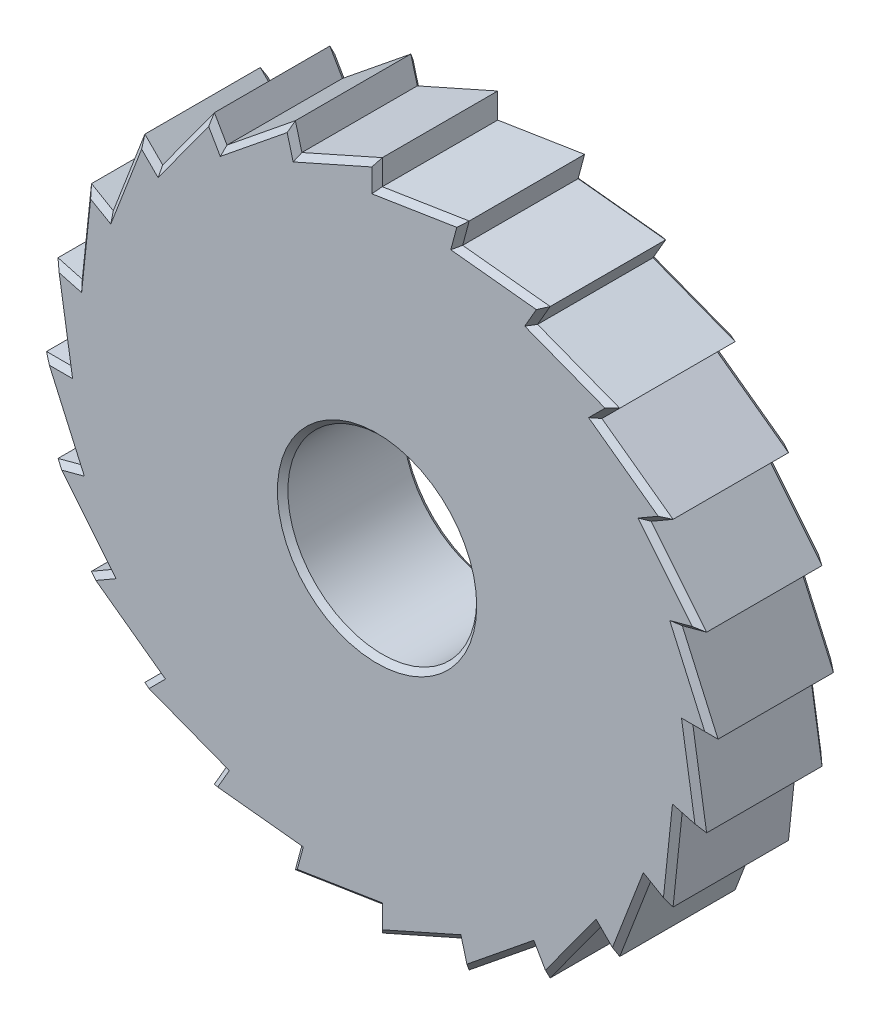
SolidWorks part; units mm, degrees
ref_plane "Спереди" through (0, 0, 0) normal (0, 0, 1) x (1, 0, 0)
ref_plane "Сверху" through (0, 0, 0) normal (0, 1, 0) x (1, 0, 0)
ref_plane "Справа" through (0, 0, 0) normal (1, 0, 0) x (0, 0, -1)
sketch "Эскиз1" plane through (0, 0, 0) normal (0, 0, 1) x (1, 0, 0)
  line L0 (0, 0) -> (0, 16) construction
  line L1 (0, 16) -> (0, 14.8)
  line L2 (4.1411, 15.4548) -> (3.8305, 14.2957)
  line L3 (8, 13.8564) -> (7.4, 12.8172)
  line L4 (11.3137, 11.3137) -> (10.4652, 10.4652)
  line L5 (13.8564, 8) -> (12.8172, 7.4)
  line L6 (15.4548, 4.1411) -> (14.2957, 3.8305)
  line L7 (16, 0) -> (14.8, 0)
  line L8 (15.4548, -4.1411) -> (14.2957, -3.8305)
  line L9 (13.8564, -8) -> (12.8172, -7.4)
  line L10 (11.3137, -11.3137) -> (10.4652, -10.4652)
  line L11 (8, -13.8564) -> (7.4, -12.8172)
  line L12 (4.1411, -15.4548) -> (3.8305, -14.2957)
  line L13 (0, -16) -> (0, -14.8)
  line L14 (-4.1411, -15.4548) -> (-3.8305, -14.2957)
  line L15 (-8, -13.8564) -> (-7.4, -12.8172)
  line L16 (-11.3137, -11.3137) -> (-10.4652, -10.4652)
  line L17 (-13.8564, -8) -> (-12.8172, -7.4)
  line L18 (-15.4548, -4.1411) -> (-14.2957, -3.8305)
  line L19 (-16, 0) -> (-14.8, 0)
  line L20 (-15.4548, 4.1411) -> (-14.2957, 3.8305)
  line L21 (-13.8564, 8) -> (-12.8172, 7.4)
  line L22 (-11.3137, 11.3137) -> (-10.4652, 10.4652)
  line L23 (-8, 13.8564) -> (-7.4, 12.8172)
  line L24 (-4.1411, 15.4548) -> (-3.8305, 14.2957)
  line L25 (4.1411, 15.4548) -> (0, 14.8)
  line L26 (8, 13.8564) -> (3.8305, 14.2957)
  line L27 (11.3137, 11.3137) -> (7.4, 12.8172)
  line L28 (13.8564, 8) -> (10.4652, 10.4652)
  line L29 (15.4548, 4.1411) -> (12.8172, 7.4)
  line L30 (16, 0) -> (14.2957, 3.8305)
  line L31 (15.4548, -4.1411) -> (14.8, 0)
  line L32 (13.8564, -8) -> (14.2957, -3.8305)
  line L33 (11.3137, -11.3137) -> (12.8172, -7.4)
  line L34 (8, -13.8564) -> (10.4652, -10.4652)
  line L35 (4.1411, -15.4548) -> (7.4, -12.8172)
  line L36 (0, -16) -> (3.8305, -14.2957)
  line L37 (-4.1411, -15.4548) -> (0, -14.8)
  line L38 (-8, -13.8564) -> (-3.8305, -14.2957)
  line L39 (-11.3137, -11.3137) -> (-7.4, -12.8172)
  line L40 (-13.8564, -8) -> (-10.4652, -10.4652)
  line L41 (-15.4548, -4.1411) -> (-12.8172, -7.4)
  line L42 (-16, 0) -> (-14.2957, -3.8305)
  line L43 (-15.4548, 4.1411) -> (-14.8, 0)
  line L44 (-13.8564, 8) -> (-14.2957, 3.8305)
  line L45 (-11.3137, 11.3137) -> (-12.8172, 7.4)
  line L46 (-8, 13.8564) -> (-10.4652, 10.4652)
  line L47 (-4.1411, 15.4548) -> (-7.4, 12.8172)
  line L48 (0, 16) -> (-3.8305, 14.2957)
  circle A0 centre (0, 0) radius 4.5
  circle A1 centre (0, 0) radius 16 construction
  dimension "D1" = 9
  dimension "D2" = 32
  dimension "D3" = 1.2
  dimension "D5" = 24
  dimension "D4" = 24
extrude "Бобышка-Вытянуть1" add sketch "Эскиз1" along normal blind 6
chamfer "Фаска1" distance 0.25 angle 45 98 edges at (4.5, 0, 0) (-3.9858, 14.8753, 0) (-5.7706, 14.136, 0) (-7.7, 13.3368, 0) (-9.2326, 12.1608, 0) (-10.8894, 10.8894, 0) (-12.0654, 9.3569, 0) (-13.3368, 7.7, 0) (-14.0761, 5.9153, 0) (-14.8753, 3.9858, 0) (-15.1274, 2.0706, 0) (-15.4, 0, 0) (-15.1479, -1.9153, 0) (-14.8753, -3.9858, 0) (-14.136, -5.7706, 0) (-13.3368, -7.7, 0) (-12.1608, -9.2326, 0) (-10.8894, -10.8894, 0) (-9.3569, -12.0654, 0) (-7.7, -13.3368, 0) (-5.9153, -14.0761, 0) (-3.9858, -14.8753, 0) (-2.0706, -15.1274, 0) (0, -15.4, 0) (1.9153, -15.1479, 0) (3.9858, -14.8753, 0) (5.7706, -14.136, 0) (7.7, -13.3368, 0) (9.2326, -12.1608, 0) (10.8894, -10.8894, 0) (12.0654, -9.3569, 0) (13.3368, -7.7, 0) (14.0761, -5.9153, 0) (14.8753, -3.9858, 0) (15.1274, -2.0706, 0) (15.4, 0, 0) (15.1479, 1.9153, 0) (14.8753, 3.9858, 0) (14.136, 5.7706, 0) (13.3368, 7.7, 0) (12.1608, 9.2326, 0) (10.8894, 10.8894, 0) (9.3569, 12.0654, 0) (7.7, 13.3368, 0) (5.9153, 14.0761, 0) (3.9858, 14.8753, 0) (2.0706, 15.1274, 0) (0, 15.4, 0) (-1.9153, 15.1479, 0) (4.5, 0, 6) (0, 15.4, 6) (2.0706, 15.1274, 6) (3.9858, 14.8753, 6) (5.9153, 14.0761, 6) (7.7, 13.3368, 6) (9.3569, 12.0654, 6) (10.8894, 10.8894, 6) (12.1608, 9.2326, 6) (13.3368, 7.7, 6) (14.136, 5.7706, 6) (14.8753, 3.9858, 6) (15.1479, 1.9153, 6) (15.4, 0, 6) (15.1274, -2.0706, 6) (14.8753, -3.9858, 6) (14.0761, -5.9153, 6) (13.3368, -7.7, 6) (12.0654, -9.3569, 6) (10.8894, -10.8894, 6) (9.2326, -12.1608, 6) (7.7, -13.3368, 6) (5.7706, -14.136, 6) (3.9858, -14.8753, 6) (1.9153, -15.1479, 6) (0, -15.4, 6) (-2.0706, -15.1274, 6) (-3.9858, -14.8753, 6) (-5.9153, -14.0761, 6) (-7.7, -13.3368, 6) (-9.3569, -12.0654, 6) (-10.8894, -10.8894, 6) (-12.1608, -9.2326, 6) (-13.3368, -7.7, 6) (-14.136, -5.7706, 6) (-14.8753, -3.9858, 6) (-15.1479, -1.9153, 6) (-15.4, 0, 6) (-15.1274, 2.0706, 6) (-14.8753, 3.9858, 6) (-14.0761, 5.9153, 6) (-13.3368, 7.7, 6) (-12.0654, 9.3569, 6) (-10.8894, 10.8894, 6) (-9.2326, 12.1608, 6) (-7.7, 13.3368, 6) (-5.7706, 14.136, 6) (-3.9858, 14.8753, 6) (-1.9153, 15.1479, 6)
